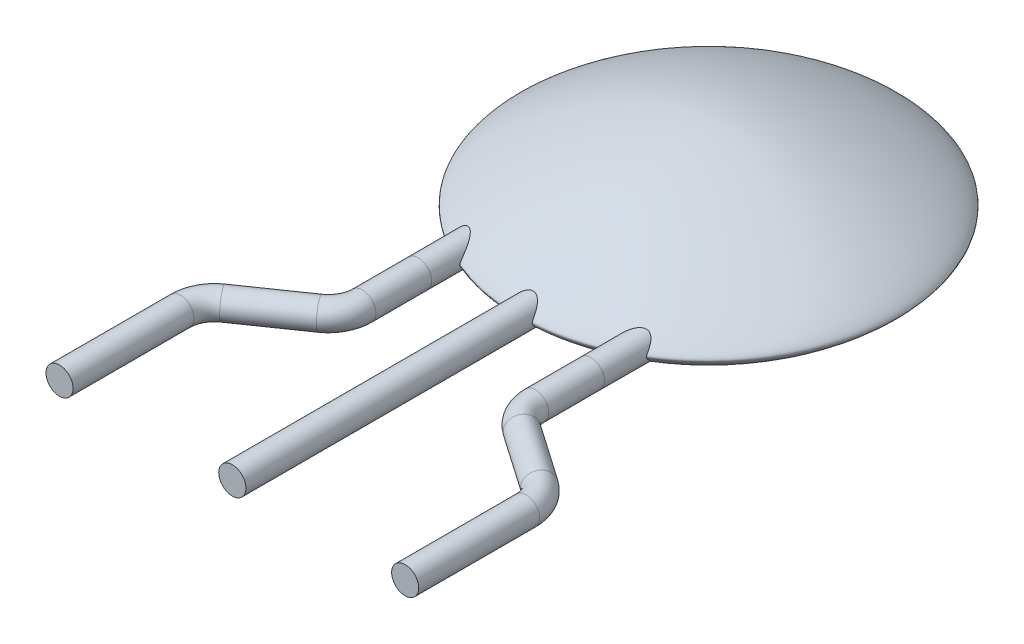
SolidWorks part; units mm, degrees
ref_plane "Plan de face" through (0, 0, 0) normal (0, 0, 1) x (1, 0, 0)
ref_plane "Plan de dessus" through (0, 0, 0) normal (0, 1, 0) x (1, 0, 0)
ref_plane "Plan de droite" through (0, 0, 0) normal (1, 0, 0) x (0, 0, -1)
sketch "Esquisse1" plane through (0, 0, 0) normal (0, 0, 1) x (1, 0, 0)
  line L4 (0, 1.05) -> (0, -1.05)
  spline S0 degree 3 poles (0, 1.05) (-1.1725, 1.05) (-2.8, 0.1619) (-2.8, -0.1619) (-1.2957, -1.05) (0, -1.05) knots 0 0 0 0 0.5 0.5 1 1 1 1
  dimension "D1" = 2.1
revolve "Révolution1" add sketch "Esquisse1" angle 360 about L4
ref_plane "Plan1" through (0, 0, 3) normal (0, 0, 1) x (1, 0, 0)
sketch "Esquisse2" plane through (0, 0, 3) normal (0, 0, 1) x (1, 0, 0)
  circle A0 centre (-1.27, 0) radius 0.2
  circle A1 centre (1.27, 0) radius 0.2
  dimension "D1" = 1.27
  dimension "D2" = 1.27
extrude "Extrusion1" add sketch "Esquisse2" against normal up to next
sketch "Esquisse3" plane through (0, 0, 3) normal (0, 0, 1) x (1, 0, 0)
  line L0 (0, 1.6388) -> (0, -2.0874) construction
  circle A0 centre (-1.27, 0) radius 0.199
sketch "Esquisse4" plane through (0, 0, 0) normal (0, 1, 0) x (1, 0, 0)
  line L0 (0, -1.9103) -> (0, -7.9685) construction
  line L1 (-2.6432, -3) -> (3.2556, -3) construction
  line L2 (-4.3969, -7) -> (4.56, -7) construction
  line L3 (-1.27, -2.5625) -> (-1.27, -3.9248) construction
  line L4 (-2.54, -7.6206) -> (-2.54, -4.3886) construction
  line L5 (-1.27, -3) -> (-1.27, -3.8184)
  line L6 (-1.4851, -4.2293) -> (-2.3249, -4.8115)
  line L7 (-2.54, -5.2224) -> (-2.54, -7)
  arc A0 (-1.27, -3.8184) -> (-1.4851, -4.2293) centre (-1.77, -3.8184) cw
  arc A1 (-2.3249, -4.8115) -> (-2.54, -5.2224) centre (-2.04, -5.2224) ccw
  dimension "D3" = 0.5
  dimension "D1" = 4
  dimension "D2" = 2.54
sweep "Balayage1" add profiles "Esquisse3" path "Esquisse4"
ref_plane "Plan3" through (0, 0, 0) normal (1, 0, 0) x (0, 0, -1)
mirror "Symétrie1" about plane through (0, 0, 0) normal (1, 0, 0) of "Balayage1"
ref_plane "Plan4" through (0, 0, 0) normal (0, 0, 1) x (1, 0, 0)
sketch "Esquisse5" plane through (0, 0, 0) normal (0, 0, 1) x (1, 0, 0)
  circle A0 centre (0, 0) radius 0.2
extrude "Boss.-Extru.1" add sketch "Esquisse5" along normal blind 7
